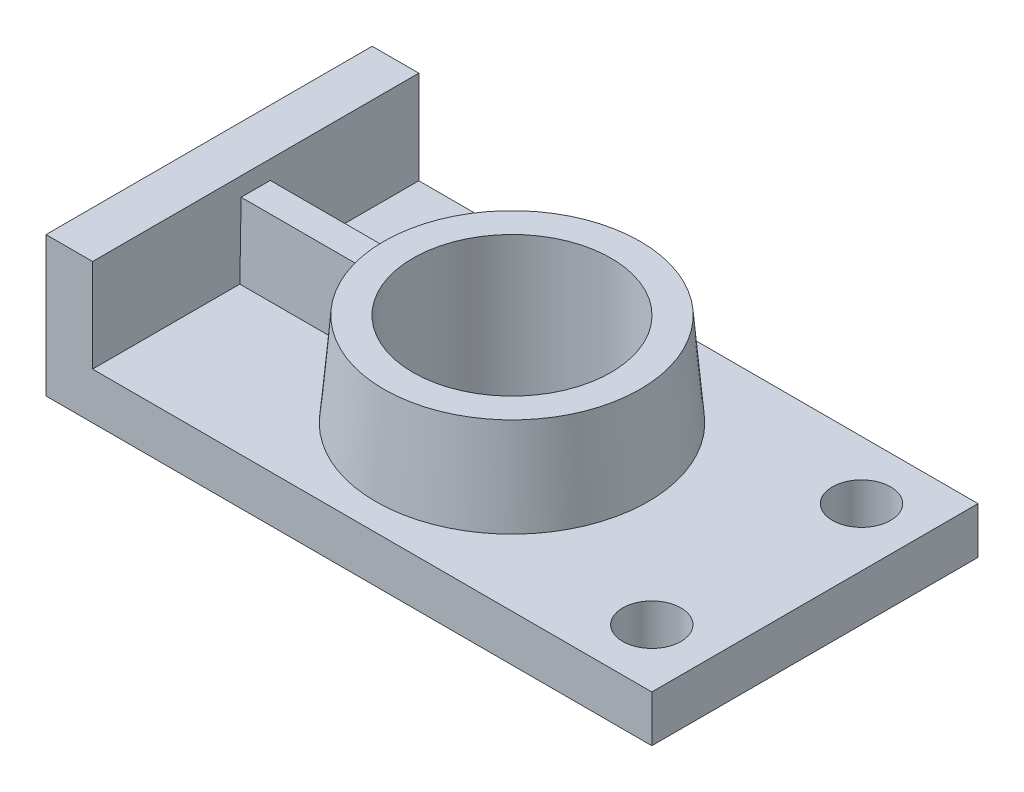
SolidWorks part; units mm, degrees
ref_plane "Plane1" through (0, 0, 0) normal (0, 0, 1) x (1, 0, 0)
ref_plane "Plane2" through (0, 0, 0) normal (0, 1, 0) x (1, 0, 0)
ref_plane "Plane3" through (0, 0, 0) normal (1, 0, 0) x (0, 0, -1)
sketch "Sketch1" plane through (0, 0, 0) normal (0, 0, 1) x (1, 0, 0)
  line L0 (0, 38.1) -> (0, 0)
  line L1 (0, 0) -> (165.1, 0)
  dimension "D1" = 165.1
  dimension "D2" = 38.1
extrude "Base-Extrude-Thin" add sketch "Sketch1" against normal blind 88.9 thin
sketch "Sketch2" plane through (0, 38.1, 0) normal (0, 1, 0) x (-1, 0, 0)
  line L0 (0, -88.9) -> (-165.1, 0) construction
  circle A0 centre (-82.55, -44.45) radius 34.925
  dimension "D1" = 69.85
extrude "Boss-Extrude1" add sketch "Sketch2" against normal up to next draft 5
sketch "Sketch3" plane through (0, 38.1, 0) normal (0, 1, 0) x (-1, 0, 0)
  circle A0 centre (-82.55, -44.45) radius 26.9875
  dimension "D1" = 53.975
extrude "Cut-Extrude1" cut sketch "Sketch3" against normal through all
sketch "Sketch4" plane through (0, 12.7, 0) normal (0, 1, 0) x (-1, 0, 0)
  line L0 (-12.7, 0) -> (-165.1, 0) construction
  line L1 (-165.1, -88.9) -> (-165.1, 0) construction
  line L2 (-12.7, -88.9) -> (-165.1, -88.9) construction
  circle A0 centre (-149.225, -15.875) radius 7.9375
  circle A1 centre (-149.225, -73.025) radius 7.9375
  dimension "D1" = 15.875
  dimension "D2" = 15.875
  dimension "D3" = 15.875
  dimension "D4" = 15.875
extrude "Cut-Extrude2" cut sketch "Sketch4" against normal through all
ref_plane "Rib Plane" through (0, 33.02, 0) normal (0, 1, 0) x (-1, 0, 0)
sketch "Sketch5" plane through (0, 33.02, 0) normal (0, 1, 0) x (-1, 0, 0)
  line L0 (-42.7788, -44.45) -> (-21.6504, -44.45)
rib "Rib1" sketch "Sketch5" sketch "Sketch5" thickness 7.9375 extrusion direction normal to sketch draft on yes draft angle 1 parameters "D1"=7.9375, "D3"=1
